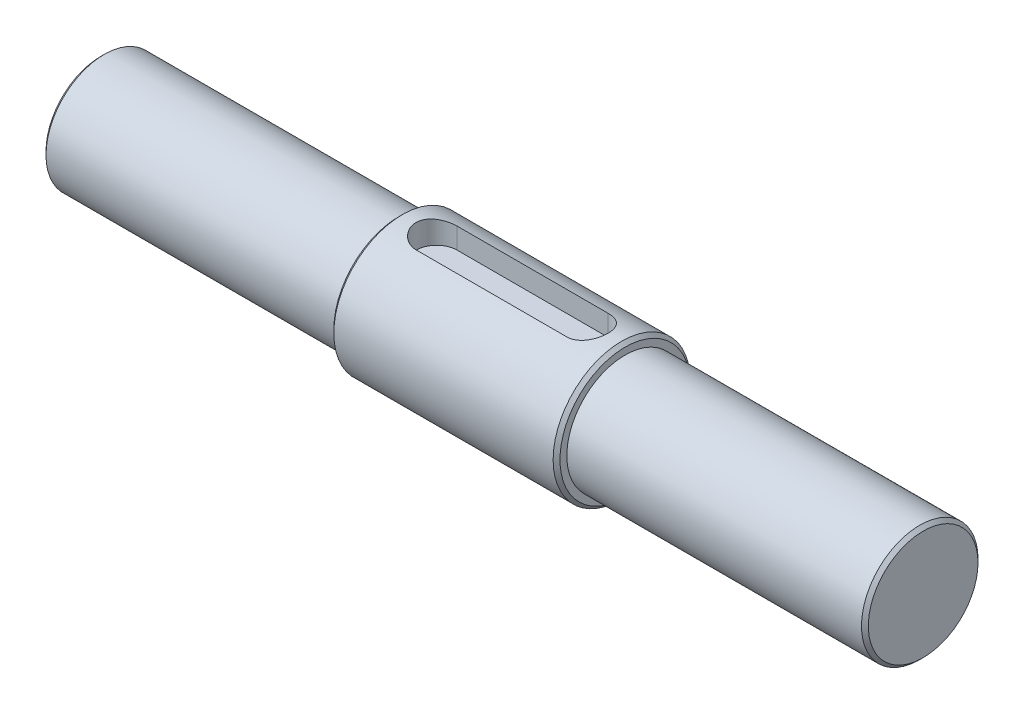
SolidWorks part; units mm, degrees
ref_plane "Front Plane" through (0, 0, 0) normal (0, 0, 1) x (1, 0, 0)
ref_plane "Top Plane" through (0, 0, 0) normal (0, 1, 0) x (1, 0, 0)
ref_plane "Right Plane" through (0, 0, 0) normal (1, 0, 0) x (0, 0, -1)
ref_plane "Plane1" through (0, 0, 0) normal (0, 0, -1) x (-1, 0, 0)
sketch "Sketch1" plane through (0, 0, 0) normal (0, 0, -1) x (-1, 0, 0)
  line L0 (-78.5, 10) -> (-78.5, 0)
  line L1 (-78.5, 0) -> (-45.5, 0)
  line L2 (-45.5, 0) -> (-45.5, 10)
  line L3 (-45.5, 10) -> (-78.5, 10)
  line L4 (-78.5, 0) -> (-45.5, 0) construction
  dimension "D1" = 33
  dimension "D2" = 10
revolve "Revolve1" add sketch "Sketch1" angle 360 about L4
sketch "Sketch2" plane through (78.5, 0, 0) normal (1, 0, 0) x (0, 0, -1)
  circle A0 centre (0, 0) radius 8.5
  dimension "D1" = 17
extrude "Boss-Extrude1" add sketch "Sketch2" along normal blind 43.5
sketch "Sketch3" plane through (45.5, 0, 0) normal (-1, 0, 0) x (0, 0, 1)
  circle A0 centre (0, 0) radius 8.5
  dimension "D1" = 17
extrude "Boss-Extrude2" add sketch "Sketch3" along normal blind 43.5
imported_body "Surface-Imported1"
ref_plane "Plane2" through (0, 6.5, 0) normal (0, -1, 0) x (1, 0, 0)
sketch "Sketch4" plane through (0, 6.5, 0) normal (0, -1, 0) x (1, 0, 0)
  line L0 (73, 3) -> (51, 3)
  line L1 (51, -3) -> (73, -3)
  line L2 (45.5, 10) -> (45.5, -10) construction
  arc A0 (73, -3) -> (73, 3) centre (73, 0) ccw
  arc A1 (51, 3) -> (51, -3) centre (51, 0) ccw
  dimension "D1" = 3
  dimension "D2" = 22
  dimension "D3" = 5.5
extrude "Cut-Extrude1" cut sketch "Sketch4" against normal up to surface (3.0394 mm away)
chamfer "Chamfer1" distance 0.5 angle 45 4 edges at (2, 0, 8.5) (45.5, 0, 10) (122, 0, -8.5) (78.5, 0, 10)
